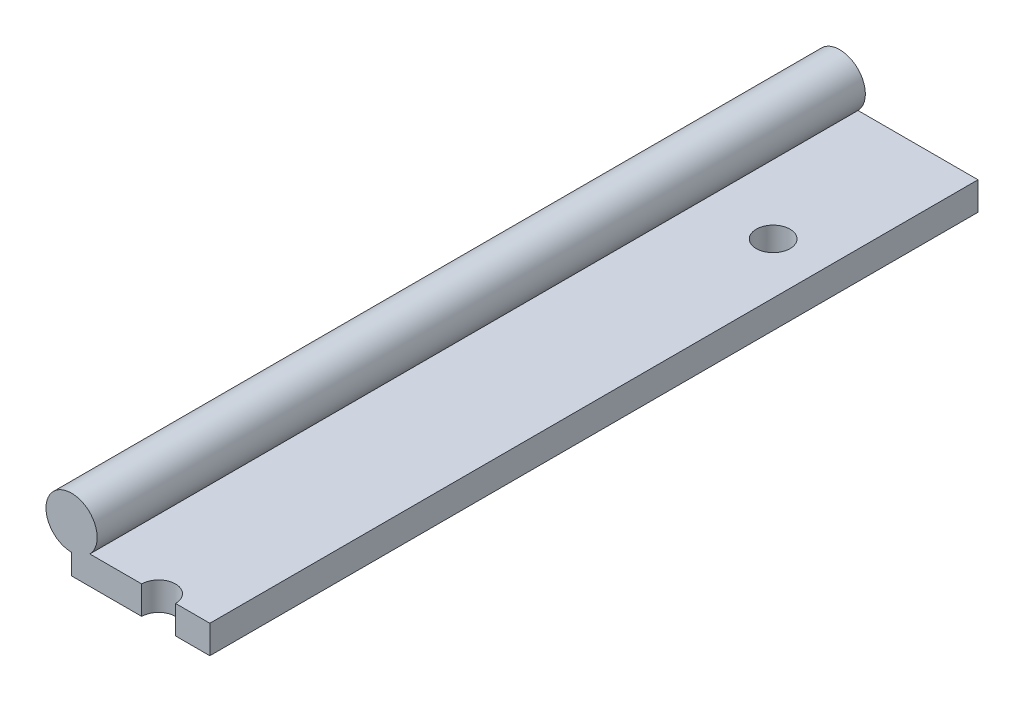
SolidWorks part; units mm, degrees
ref_plane "Alzado" through (0, 0, 0) normal (0, 0, 1) x (1, 0, 0)
ref_plane "Planta" through (0, 0, 0) normal (0, 1, 0) x (1, 0, 0)
ref_plane "Vista lateral" through (0, 0, 0) normal (1, 0, 0) x (0, 0, -1)
sketch "Croquis1" plane through (0, 0, 0) normal (0, 0, 1) x (1, 0, 0)
  line L1 (13.5, 2.75) -> (-9.9293, 2.75)
  line L2 (13.5, 2.75) -> (13.5, -2.75)
  line L3 (13.5, -2.75) -> (-13.5, -2.75)
  line L4 (-13.5, 1.25) -> (-13.5, -2.75)
  arc A0 (-13.5, 1.25) -> (-9.9293, 2.75) centre (-13.5, 6.25) cw
extrude "Extruir1" add sketch "Croquis1" along normal blind 150
sketch "Croquis2" plane through (0, 2.75, 0) normal (0, 1, 0) x (1, 0, 0)
  point P0 (3.5, -30)
  point P1 (3.5, -150)
hole_wizard "Taladro de diámetro de Ø6.6 (6.6)1" positions "Croquis3D1" profile "Croquis3" hole size "Ø6.6" standard "DIN"
sketch3d "Croquis3D1"
  point P0 (3.5, 2.75, 30)
  point P3 (3.5, 2.75, 150)
sketch "Croquis3" plane through (3.5, 2.75, 30) normal (1, 0, 0) x (0, 0, 1)
  line L0 (0, 0) -> (0, 18.4828)
  line L1 (0, 18.4828) -> (3.3, 16.5)
  line L2 (3.3, 16.5) -> (3.3, 0)
  line L5 (3.3, 0) -> (0, 0)
  line L10 (0, 18.4828) -> (-3.3, 16.5) construction
  line L11 (0, -6.35) -> (0, 107.95) construction
  dimension "Diámetro de taladro" = 6.6
  dimension "Profundidad de taladro" = 16.5
  dimension "Ángulo de perforador" = 118
